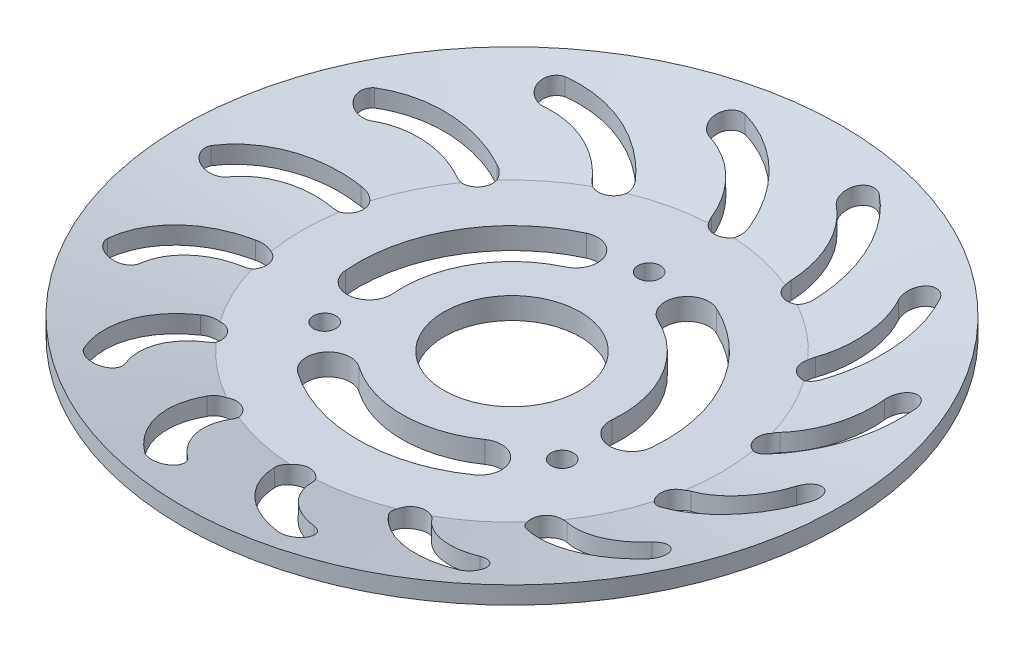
SolidWorks part; units mm, degrees
ref_plane "Front Plane" through (0, 0, 0) normal (0, 0, 1) x (1, 0, 0)
ref_plane "Top Plane" through (0, 0, 0) normal (0, 1, 0) x (1, 0, 0)
ref_plane "Right Plane" through (0, 0, 0) normal (1, 0, 0) x (0, 0, -1)
sketch "Sketch1" plane through (0, 0, 0) normal (0, 1, 0) x (1, 0, 0)
  circle A0 centre (0, 0) radius 95.25
  dimension "D1" = 190.5
extrude "Boss-Extrude1" add sketch "Sketch1" along normal blind 15.0812
sketch "Sketch2" plane through (0, 0, 0) normal (0, 0, 1) x (1, 0, 0)
  line L0 (28.829, 15.0812) -> (28.829, 6.2465)
  line L1 (95.25, 15.0812) -> (-95.25, 15.0812) construction
  line L2 (28.829, 6.2465) -> (60.579, 6.2465)
  line L3 (60.579, 6.2465) -> (95.25, 15.0812)
  line L4 (95.25, 0) -> (95.25, 15.0812) construction
  line L5 (28.829, 15.0812) -> (95.25, 15.0812)
  line L6 (95.25, 10.0012) -> (56.0013, 0)
  line L7 (-95.25, 0) -> (95.25, 0) construction
  line L8 (95.25, 15.0812) -> (95.25, 10.0012)
  line L9 (56.0013, 0) -> (28.829, 0)
  line L10 (28.829, 0) -> (28.829, 6.2465)
  line L11 (56.0013, 0) -> (95.25, 0)
  line L12 (95.25, 0) -> (95.25, 10.0012)
  line L13 (0, 0) -> (0, 77.0229) construction
  line L14 (28.829, 6.2465) -> (0, 6.2465)
  line L15 (0, 6.2465) -> (0, 15.0812)
  line L16 (0, 15.0812) -> (28.829, 15.0812)
  line L17 (28.829, 15.0812) -> (0, 15.0812)
  line L18 (0, 15.0812) -> (28.829, 15.0812)
  dimension "D1" = 8.8348
  dimension "D2" = 28.829
  dimension "D3" = 31.75
  dimension "D4" = 5.08
revolve "Cut-Revolve1" cut sketch "Sketch2" angle 360 about L13
sketch "Sketch3" plane through (0, 15.0812, 0) normal (0, 1, 0) x (1, 0, 0)
  circle A0 centre (0, 0) radius 19.685
  dimension "D1" = 39.37
extrude "Cut-Extrude1" cut sketch "Sketch3" against normal up to next
sketch "Sketch4" plane through (0, 6.2465, 0) normal (0, 1, 0) x (1, 0, 0)
  circle A0 centre (0, 39.6342) radius 3.2385
  circle A1 centre (0, 0) radius 28.829 construction
  dimension "D1" = 6.477
  dimension "D2" = 39.6342
extrude "Cut-Extrude2" cut sketch "Sketch4" against normal up to next
pattern_circular "CirPattern1" count 3 over 360 about axis through (0, 0, 0) along (0, 1, 0) of "Cut-Extrude2"
sketch "Sketch5" plane through (0, 15.0812, 0) normal (0, 1, 0) x (1, 0, 0)
  line L0 (0, 0) -> (0, 156.7805) construction
  line L1 (-123.494, 0) -> (143.2431, 0) construction
  circle A0 centre (0, 0) radius 95.25 construction
  point P5 (0, 95.25)
sketch "Sketch6" plane through (0, 6.2465, 0) normal (0, 1, 0) x (1, 0, 0)
  circle A0 centre (0, 0) radius 60.579 construction
  point P0 (0, 60.579)
ref_plane "Plane1" through (0, 15.0812, 0) normal (0, 1, 0) x (-1, 0, 0)
sketch "Sketch7" plane through (0, 15.0812, 0) normal (0, 1, 0) x (-1, 0, 0)
  arc A0 (0, 62.9691) -> (-19.05, 81.5723) centre (-24.6392, 56.7935) ccw construction
  arc A1 (-18.5836, 85.9928) -> (-20.0947, 77.2518) centre (-19.05, 81.5723) ccw
  arc A2 (-18.5836, 85.9928) -> (4.1564, 64.5445) centre (-24.6392, 56.7935) cw
  arc A3 (-4.3278, 61.9549) -> (4.1564, 64.5445) centre (0, 62.9691) ccw
  arc A4 (-20.0947, 77.2518) -> (-4.3278, 61.9549) centre (-24.6392, 56.7935) cw
  point P3 (-10.9557, 77.7519)
  dimension "D2" = 4.445
  dimension "D4" = 19.05
  dimension "D5" = 4.445
  dimension "D6" = 20.957
  dimension "D7" = 29.8206
sketch "Sketch8" plane through (0, 6.2465, 0) normal (0, 1, 0) x (1, 0, 0)
  line L0 (0, 0) -> (16.1018, 34.5303) construction
  line L1 (0, 0) -> (37.955, -3.3206) construction
  line L2 (0, 0) -> (0, 59.8747) construction
  circle A1 centre (0, 0) radius 24.9287
  arc A2 (37.955, -3.3206) -> (16.1018, 34.5303) centre (0, 0) ccw construction
  arc A3 (44.2809, -3.8741) -> (18.7854, 40.2854) centre (0, 0) ccw
  arc A4 (31.6292, -2.7672) -> (13.4181, 28.7753) centre (0, 0) ccw
  arc A5 (31.6292, -2.7672) -> (44.2809, -3.8741) centre (37.955, -3.3206) ccw
  arc A6 (18.7854, 40.2854) -> (13.4181, 28.7753) centre (16.1018, 34.5303) ccw
  point P6 (32.9956, 19.05)
  dimension "D1" = 49.8574
  dimension "D2" = 38.1
  dimension "D5" = 6.35
  dimension "D3" = 25
  dimension "D4" = 70
  dimension "D6" = 34.5303
  dimension "D7" = 35.8023
extrude "Cut-Extrude3" cut sketch "Sketch8" against normal up to next contours A3 A6 A4 A5
pattern_circular "CirPattern3" count 3 over 360 about axis through (0, 0, 0) along (0, 1, 0) of "Cut-Extrude3"
sketch "Sketch9" plane through (0, 15.0812, 0) normal (0, 1, 0) x (1, 0, 0)
  circle A1 centre (0, 0) radius 28.829
  circle A2 centre (0, 0) radius 28.829
  dimension "D1" = 0
extrude "Cut-Extrude4" cut sketch "Sketch9" against normal up to surface (8.8348 mm away)
extrude "Cut-Extrude5" cut sketch "Sketch7" against normal through all
pattern_circular "CirPattern4" count 14 over 360 about axis through (0, 0, 0) along (0, 1, 0) of "Cut-Extrude5"
